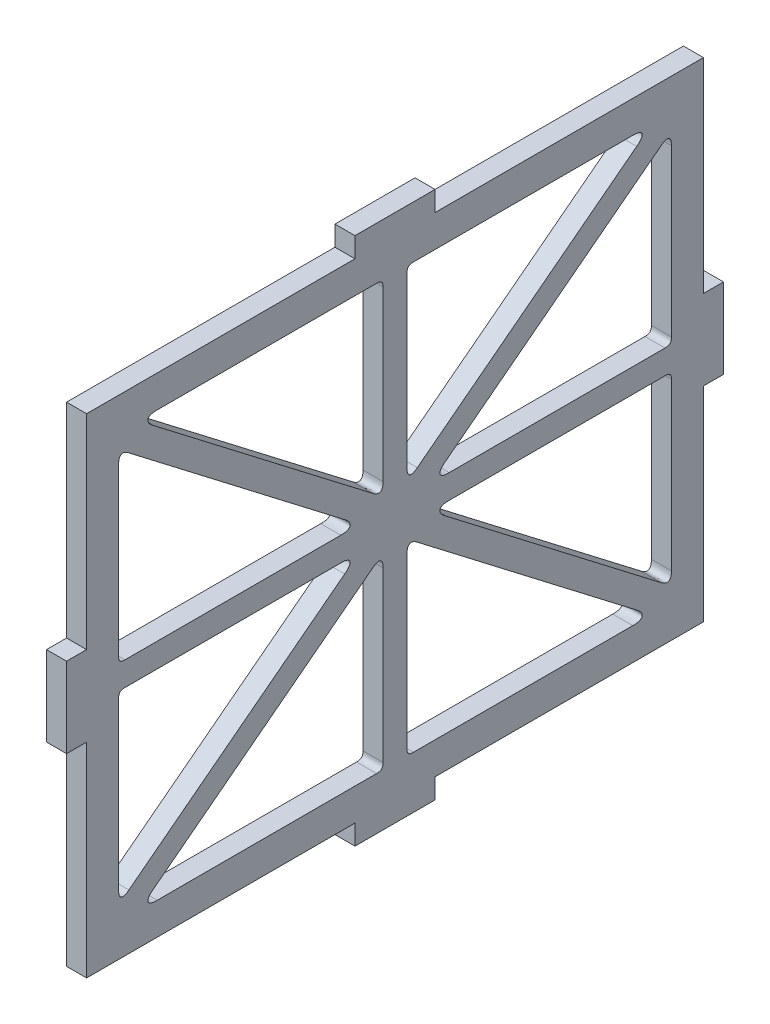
SolidWorks part; units mm, degrees
ref_plane "前视基准面" through (0, 0, 0) normal (0, 0, 1) x (1, 0, 0)
ref_plane "上视基准面" through (0, 0, 0) normal (0, 1, 0) x (1, 0, 0)
ref_plane "右视基准面" through (0, 0, 0) normal (1, 0, 0) x (0, 0, -1)
sketch "草图1" plane through (0, 0, 0) normal (1, 0, 0) x (0, 0, -1)
  line L1 (-38.5, -30.5) -> (38.5, -30.5)
  line L2 (-38.5, -30.5) -> (-38.5, 30.5)
  line L3 (-38.5, 30.5) -> (38.5, 30.5)
  line L4 (38.5, -30.5) -> (38.5, 30.5)
  line L5 (-38.5, -30.5) -> (38.5, 30.5) construction
  line L6 (-38.5, 30.5) -> (38.5, -30.5) construction
  point P0 (0, 0)
  dimension "D1" = 61
  dimension "D2" = 77
extrude "凸台-拉伸1" add sketch "草图1" along normal blind 2.5
sketch "草图2" plane through (2.5, 0, 0) normal (1, 0, 0) x (0, 0, -1)
  line L0 (0, 0) -> (0, 39.4543) construction
  line L1 (0, 0) -> (47.8712, 0) construction
  line L2 (38.5, -30.5) -> (38.5, 30.5) construction
  line L3 (38.5, 5) -> (41, 5)
  line L4 (38.5, 5) -> (38.5, -5)
  line L5 (38.5, -5) -> (41, -5)
  line L6 (41, 5) -> (41, -5)
  line L7 (38.5, 30.5) -> (-38.5, 30.5) construction
  line L8 (-5, 30.5) -> (5, 30.5)
  line L9 (-5, 30.5) -> (-5, 33)
  line L10 (-5, 33) -> (5, 33)
  line L11 (5, 30.5) -> (5, 33)
  line L12 (5, -30.5) -> (5, -33)
  line L13 (-5, -33) -> (5, -33)
  line L14 (-5, -30.5) -> (-5, -33)
  line L15 (-5, -30.5) -> (5, -30.5)
  line L16 (-41, 5) -> (-41, -5)
  line L17 (-38.5, -5) -> (-41, -5)
  line L18 (-38.5, 5) -> (-38.5, -5)
  line L19 (-38.5, 5) -> (-41, 5)
  dimension "D1" = 10
  dimension "D2" = 2.5
  dimension "D3" = 10
  dimension "D4" = 2.5
extrude "凸台-拉伸2" add sketch "草图2" against normal up to surface (2.5 mm away)
sketch "草图3" plane through (2.5, 0, 0) normal (1, 0, 0) x (0, 0, -1)
  line L0 (-41, 0) -> (41, 0) construction
  line L1 (-41, 5) -> (-41, -5) construction
  line L2 (41, -5) -> (41, 5) construction
  line L3 (0, 33) -> (0, -33) construction
  line L4 (5, 33) -> (-5, 33) construction
  line L5 (-5, -33) -> (5, -33) construction
  line L6 (38.5, 30.5) -> (5, 30.5) construction
  line L7 (-34.5, -26.5) -> (34.5, -26.5) construction
  line L8 (-34.5, -26.5) -> (-34.5, 26.5) construction
  line L9 (-34.5, 26.5) -> (34.5, 26.5) construction
  line L10 (34.5, -26.5) -> (34.5, 26.5) construction
  line L11 (-34.5, -26.5) -> (34.5, 26.5) construction
  line L12 (-34.5, 26.5) -> (34.5, -26.5) construction
  line L13 (38.5, 5) -> (38.5, 30.5) construction
  line L14 (-34.5, 24.6086) -> (-34.5, 1.5)
  line L15 (-34.5, 1.5) -> (-4.4153, 1.5)
  line L16 (-4.4153, 1.5) -> (-34.5, 24.6086)
  line L17 (-4.4153, -1.5) -> (-34.5, -24.6086)
  line L18 (-34.5, -1.5) -> (-4.4153, -1.5)
  line L19 (-34.5, -24.6086) -> (-34.5, -1.5)
  line L20 (34.5, -24.6086) -> (34.5, -1.5)
  line L21 (34.5, -1.5) -> (4.4153, -1.5)
  line L22 (4.4153, -1.5) -> (34.5, -24.6086)
  line L23 (4.4153, 1.5) -> (34.5, 24.6086)
  line L24 (34.5, 1.5) -> (4.4153, 1.5)
  line L25 (34.5, 24.6086) -> (34.5, 1.5)
  line L26 (-32.0376, 26.5) -> (-1.5, 26.5)
  line L27 (-1.5, 26.5) -> (-1.5, 3.0436)
  line L28 (-1.5, 3.0436) -> (-32.0376, 26.5)
  line L29 (1.5, 3.0436) -> (32.0376, 26.5)
  line L30 (1.5, 26.5) -> (1.5, 3.0436)
  line L31 (32.0376, 26.5) -> (1.5, 26.5)
  line L32 (32.0376, -26.5) -> (1.5, -26.5)
  line L33 (1.5, -26.5) -> (1.5, -3.0436)
  line L34 (1.5, -3.0436) -> (32.0376, -26.5)
  line L35 (-1.5, -3.0436) -> (-32.0376, -26.5)
  line L36 (-1.5, -26.5) -> (-1.5, -3.0436)
  line L37 (-32.0376, -26.5) -> (-1.5, -26.5)
  point P12 (0, 0)
  dimension "D1" = 4
  dimension "D2" = 4
  dimension "D3" = 1.5
  dimension "D4" = 1.5
  dimension "D5" = 1.5
  dimension "D6" = 1.5
extrude "切除-拉伸1" cut sketch "草图3" against normal up to surface (2.5 mm away)
fillet "圆角1" radius 0.8 24 edges at (1.25, 26.5, 32.0376) (1.25, 3.0436, 1.5) (1.25, 26.5, 1.5) (1.25, 26.5, -1.5) (1.25, 26.5, -32.0376) (1.25, 24.6086, -34.5) (1.25, 3.0436, -1.5) (1.25, 1.5, -4.4153) (1.25, 1.5, -34.5) (1.25, -24.6086, -34.5) (1.25, -1.5, -34.5) (1.25, -1.5, -4.4153) (1.25, -26.5, -32.0376) (1.25, -3.0436, -1.5) (1.25, -26.5, -1.5) (1.25, -26.5, 1.5) (1.25, -3.0436, 1.5) (1.25, -26.5, 32.0376) (1.25, -24.6086, 34.5) (1.25, -1.5, 34.5) (1.25, -1.5, 4.4153) (1.25, 1.5, 4.4153) (1.25, 24.6086, 34.5) (1.25, 1.5, 34.5)
